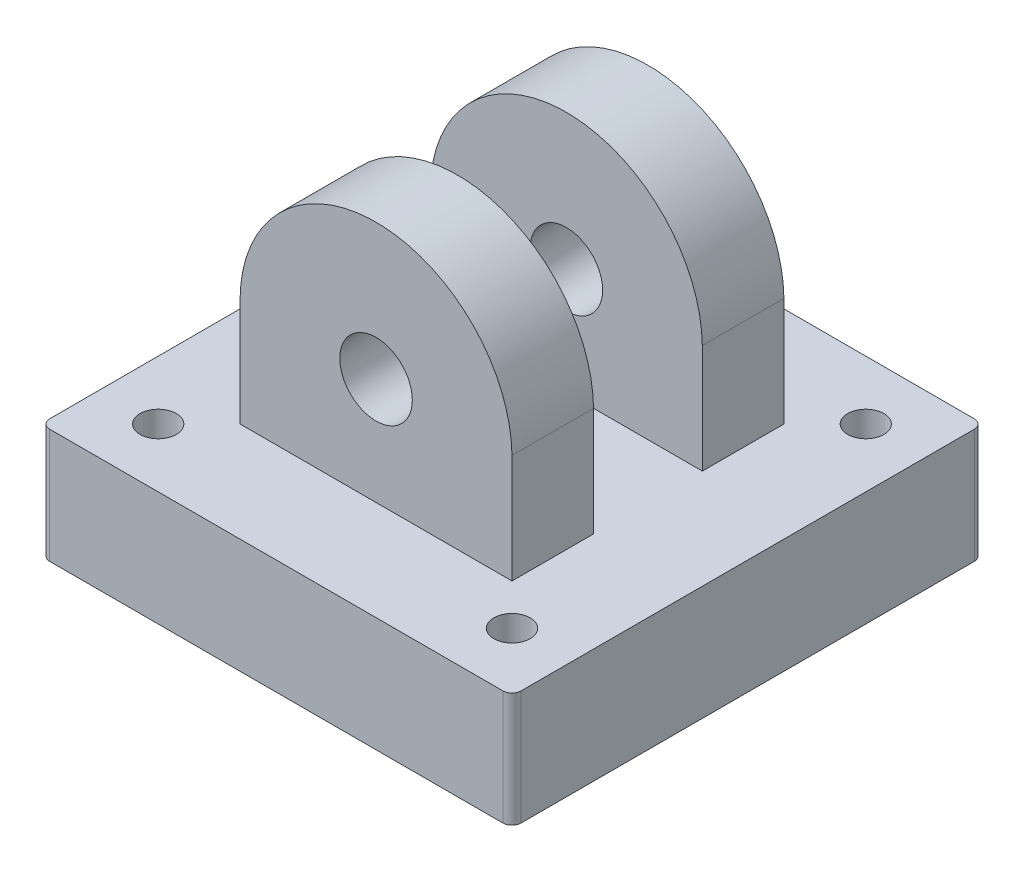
SolidWorks part; units mm, degrees
ref_plane "Front Plane" through (0, 0, 0) normal (0, 0, 1) x (1, 0, 0)
ref_plane "Top Plane" through (0, 0, 0) normal (0, 1, 0) x (1, 0, 0)
ref_plane "Right Plane" through (0, 0, 0) normal (1, 0, 0) x (0, 0, -1)
sketch "Sketch1" plane through (0, 0, 0) normal (0, 1, 0) x (1, 0, 0)
  line L1 (-82.55, 82.55) -> (82.55, 82.55)
  line L2 (-82.55, 82.55) -> (-82.55, -82.55)
  line L3 (-82.55, -82.55) -> (82.55, -82.55)
  line L4 (82.55, 82.55) -> (82.55, -82.55)
  line L5 (-82.55, 82.55) -> (82.55, -82.55) construction
  line L6 (-82.55, -82.55) -> (82.55, 82.55) construction
  point P0 (0, 0)
  dimension "D1" = 165.1
  dimension "D2" = 165.1
extrude "Boss-Extrude1" add sketch "Sketch1" along normal blind 38.1 and the other way blind 2
sketch "Sketch2" plane through (0, 38.1, 0) normal (0, 1, 0) x (1, 0, 0)
  line L1 (-47.625, 47.625) -> (47.625, 47.625)
  line L2 (-47.625, 47.625) -> (-47.625, -47.625)
  line L3 (-47.625, -47.625) -> (47.625, -47.625)
  line L4 (47.625, 47.625) -> (47.625, -47.625)
  line L5 (-47.625, 47.625) -> (47.625, -47.625) construction
  line L6 (-47.625, -47.625) -> (47.625, 47.625) construction
  point P0 (0, 0)
  dimension "D1" = 95.25
  dimension "D2" = 95.25
extrude "Boss-Extrude2" add sketch "Sketch2" along normal blind 38.1
sketch "Sketch3" plane through (0, 0, 47.625) normal (0, 0, 1) x (1, 0, 0)
  line L0 (-47.625, 76.2) -> (47.625, 76.2)
  arc A0 (47.625, 76.2) -> (-47.625, 76.2) centre (0, 75.5099) ccw
  dimension "D1" = 47.63
extrude "Boss-Extrude3" add sketch "Sketch3" against normal up to vertex (95.25 mm away)
sketch "Sketch6" plane through (0, 0, 47.625) normal (0, 0, 1) x (1, 0, 0)
  circle A0 centre (0, 75.5099) radius 12.7
  dimension "D1" = 25.4
extrude "Cut-Extrude1" cut sketch "Sketch6" against normal through all
sketch "Sketch7" plane through (-47.625, 0, 0) normal (-1, 0, 0) x (0, 0, 1)
  line L0 (-82.55, 38.1) -> (82.55, 38.1) construction
  line L1 (-19.045, 38.1) -> (19.055, 38.1)
  line L2 (-19.045, 38.1) -> (-19.045, 123.1399)
  line L3 (-19.045, 123.1399) -> (19.055, 123.1399)
  line L4 (19.055, 38.1) -> (19.055, 123.1399)
  line L5 (47.625, 123.1399) -> (-47.625, 123.1399) construction
  line L6 (-47.625, 123.1399) -> (-47.625, 76.2) construction
  dimension "D1" = 38.1
  dimension "D2" = 28.58
extrude "Cut-Extrude2" cut sketch "Sketch7" against normal through all
fillet "Fillet1" radius 3.175 4 edges at (82.55, 18.05, -82.55) (-82.55, 18.05, -82.55) (82.55, 18.05, 82.55) (-82.55, 18.05, 82.55)
sketch "Sketch8" plane through (0, -2, 0) normal (0, -1, 0) x (1, 0, 0)
  circle A0 centre (0, 0) radius 26
  dimension "D1" = 52
extrude "Cut-Extrude3" cut sketch "Sketch8" against normal blind 36.83
sketch "Sketch9" plane through (0, -2, 0) normal (0, -1, 0) x (1, 0, 0)
  circle A0 centre (0, 0) radius 76.2
  circle A1 centre (0, 0) radius 69.85
  dimension "D1" = 152.4
  dimension "D2" = 139.7
extrude "Cut-Extrude4" cut sketch "Sketch9" against normal blind 8
sketch "Sketch10" plane through (-82.55, 0, 0) normal (-1, 0, 0) x (0, 0, 1)
  line L0 (-79.375, 18.05) -> (79.375, 18.05) construction
  line L1 (-79.375, 38.1) -> (-79.375, -2) construction
  line L2 (79.375, -2) -> (79.375, 38.1) construction
  point P6 (0, 18.05)
  point P7 (-60.6913, -22.6745)
hole_wizard "1/2-14 NPSM Tapped Hole1" positions "3DSketch4" profile "Sketch13" tap size "1/2-14 NPSM" standard "ANSI Inch"
sketch3d "3DSketch4"
  point P0 (-82.55, 18.05, 0)
sketch "Sketch13" plane through (-82.55, 18.05, 0) normal (0, 1, 0) x (0, 0, 1)
  line L0 (0, 0) -> (0, 69.2303)
  line L1 (0, 69.2303) -> (9.4869, 63.53)
  line L2 (9.4869, 63.53) -> (9.4869, 1.6002)
  line L3 (9.4869, 1.6002) -> (11.0871, 0)
  line L5 (11.0871, 0) -> (0, 0)
  line L6 (-9.4869, 1.6002) -> (-11.0871, 0) construction
  line L10 (0, 69.2303) -> (-9.4869, 63.53) construction
  line L11 (0, -6.35) -> (0, 107.95) construction
  dimension "Tap Drill Dia." = 18.9738
  dimension "Tap Drill Depth" = 63.53
  dimension "Near C'Sink Dia." = 22.1742
  dimension "Near C'Sink Angle" = 90
  dimension "Drill Angle" = 118
sketch "Sketch14" plane through (0, -2, 0) normal (0, -1, 0) x (1, 0, 0)
  line L0 (-82.55, -79.375) -> (-82.55, 79.375) construction
  circle A0 centre (-50.55, 0) radius 6.35
  dimension "D1" = 12.7
  dimension "D2" = 32
extrude "Cut-Extrude5" cut sketch "Sketch14" against normal blind 25
sketch "Sketch15" plane through (0, -2, 0) normal (0, -1, 0) x (1, 0, 0)
  line L1 (-61.9638, 61.9638) -> (61.9638, 61.9638) construction
  line L2 (-61.9638, 61.9638) -> (-61.9638, -61.9638) construction
  line L3 (-61.9638, -61.9638) -> (61.9638, -61.9638) construction
  line L4 (61.9638, 61.9638) -> (61.9638, -61.9638) construction
  line L5 (-61.9638, 61.9638) -> (61.9638, -61.9638) construction
  line L6 (-61.9638, -61.9638) -> (61.9638, 61.9638) construction
  circle A0 centre (0, 0) radius 87.63 construction
  circle A1 centre (-61.9638, 61.9638) radius 6.35
  circle A2 centre (61.9638, 61.9638) radius 6.35
  circle A3 centre (61.9638, -61.9638) radius 6.35
  circle A4 centre (-61.9638, -61.9638) radius 6.35
  dimension "D1" = 175.26
  dimension "D2" = 12.7
extrude "Cut-Extrude6" cut sketch "Sketch15" against normal through all
